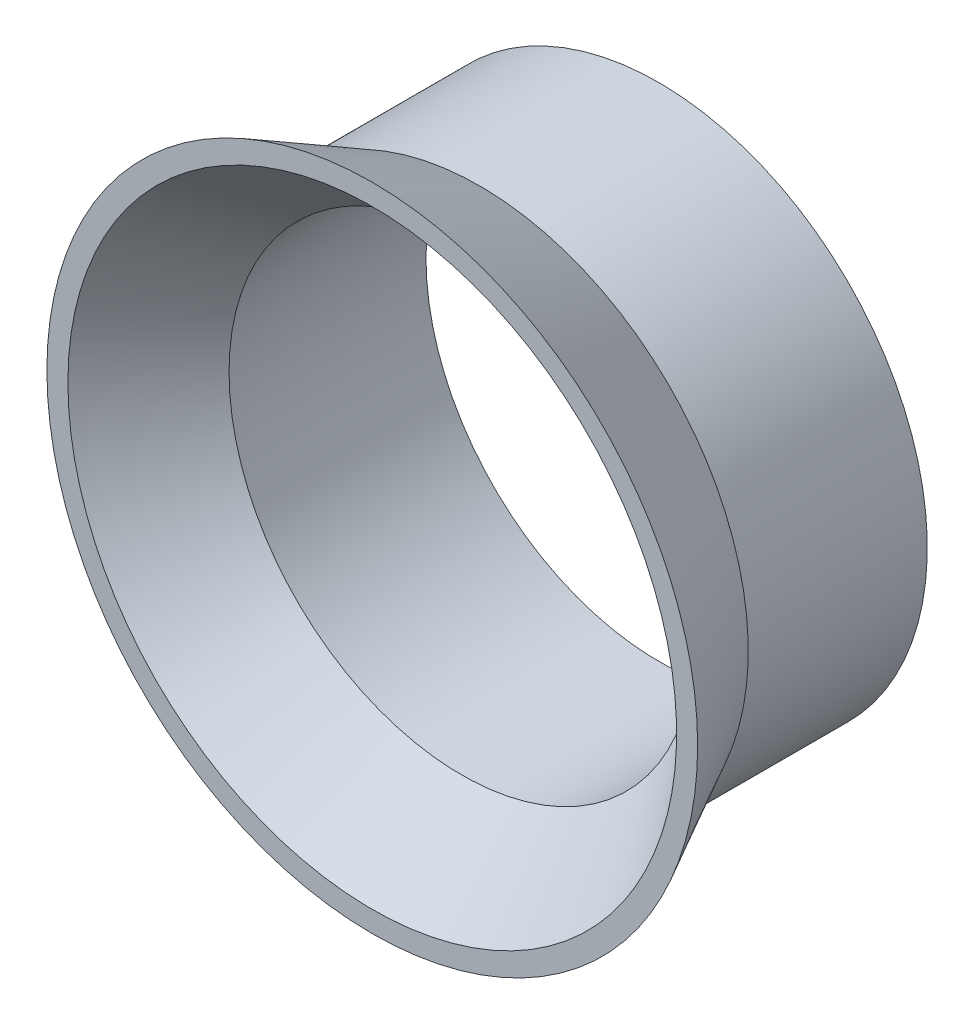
SolidWorks part; units mm, degrees
ref_plane "Front Plane" through (0, 0, 0) normal (0, 0, 1) x (1, 0, 0)
ref_plane "Top Plane" through (0, 0, 0) normal (0, 1, 0) x (1, 0, 0)
ref_plane "Right Plane" through (0, 0, 0) normal (1, 0, 0) x (0, 0, -1)
sketch "Sketch2" plane through (0, 0, 0) normal (0, 0, 1) x (1, 0, 0)
  circle A0 centre (0, 0) radius 31
  circle A1 centre (0, 0) radius 37
  dimension "D1" = 62
  dimension "D2" = 74
extrude "Boss-Extrude1" add sketch "Sketch2" along normal blind 32 contours A0 | A1
sketch "Sketch3" plane through (0, 0, 0) normal (0, 0, 1) x (1, 0, 0)
  circle A0 centre (0, 0) radius 31
extrude "Boss-Extrude3" add sketch "Sketch3" along normal blind 32
sketch "Sketch4" plane through (0, 0, 0) normal (0, 1, 0) x (1, 0, 0)
  line L0 (0, 0) -> (0, -29.5475) construction
  line L1 (37, 0) -> (-37, 0) construction
  line L2 (30, 0) -> (30, -20)
  line L3 (30, -20) -> (36.3468, -32)
  line L4 (-37, -32) -> (37, -32) construction
  line L5 (36.3468, -32) -> (37, -32)
  line L6 (37, -32) -> (37, 0)
  line L7 (37, 0) -> (30, 0)
  dimension "D1" = 30
  dimension "D2" = 20
revolve "Cut-Revolve1" cut sketch "Sketch4" angle 360 about L0
sketch "Sketch5" plane through (0, 0, 0) normal (0, 1, 0) x (1, 0, 0)
  line L0 (0, 0) -> (0, -32) construction
  line L1 (-36.3468, -32) -> (36.3468, -32) construction
  line L2 (26, 0) -> (0, 0)
  line L3 (34, -32) -> (0, -32)
  line L4 (0, 0) -> (0, -32)
  line L5 (26, -22) -> (34, -32)
  line L6 (26, -22) -> (26, 0)
  line L7 (30, 0) -> (-30, 0) construction
  point P6 (32.5, -32)
  point P12 (32.4496, -32)
  dimension "D1" = 26
  dimension "D2" = 34
  dimension "D3" = 10
revolve "Cut-Revolve2" cut sketch "Sketch5" angle 360 about L0
